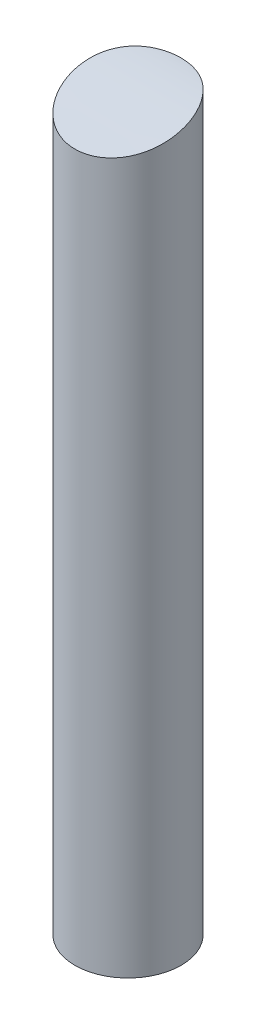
SolidWorks part; units mm, degrees
ref_plane "Front Plane" through (0, 0, 0) normal (0, 0, 1) x (1, 0, 0)
ref_plane "Top Plane" through (0, 0, 0) normal (0, 1, 0) x (1, 0, 0)
ref_plane "Right Plane" through (0, 0, 0) normal (1, 0, 0) x (0, 0, -1)
sketch "Sketch1" plane through (0, 0, 0) normal (0, 1, 0) x (1, 0, 0)
  circle A0 centre (0, 0) radius 1
  dimension "D1" = 2
extrude "Boss-Extrude1" add sketch "Sketch1" along normal blind 15
sketch "Sketch2" plane through (0, 0, 0) normal (1, 0, 0) x (0, 0, -1)
  line L1 (-4.4504, 13.5624) -> (-1.647, 12.3359) construction
  line L2 (-1.647, 12.3359) -> (-0.7009, 13.5974) construction
  line L3 (-0.7009, 13.5974) -> (1.5419, 14.4034) construction
  line L4 (1.5419, 14.4034) -> (1.5419, 13.3171) construction
  line L5 (1.5419, 13.3171) -> (1.5419, 16.3307)
  line L6 (1.5419, 16.3307) -> (-4.4504, 16.3307)
  line L7 (-4.4504, 16.3307) -> (-4.4504, 13.5624)
  spline_without_curve S0
extrude "Cut-Extrude1" cut sketch "Sketch2" against normal mid plane 5
